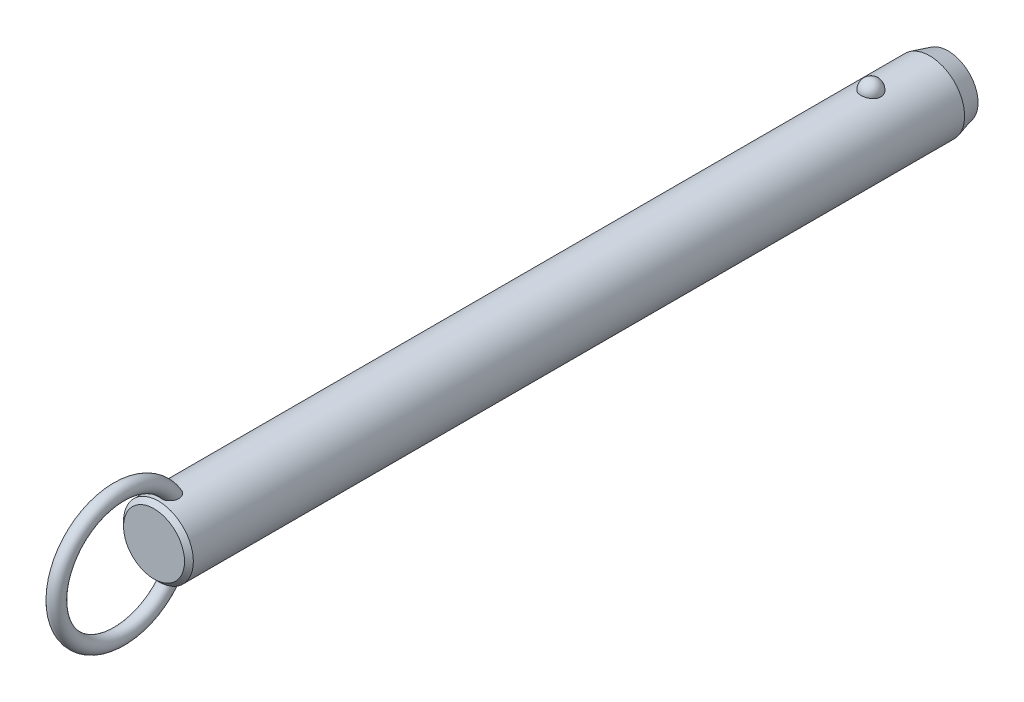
SolidWorks part; units mm, degrees
ref_plane "Front Plane" through (0, 0, 0) normal (0, 0, 1) x (1, 0, 0)
ref_plane "Top Plane" through (0, 0, 0) normal (0, 1, 0) x (1, 0, 0)
ref_plane "Right Plane" through (0, 0, 0) normal (1, 0, 0) x (0, 0, -1)
sketch "Sketch2" plane through (0, 0, 0) normal (0, 0, 1) x (1, 0, 0)
  circle A0 centre (0, 0) radius 9.5
  point P3 (0, 9.5)
  dimension "D1" = 19
extrude "Boss-Extrude1" add sketch "Sketch2" along normal blind 182.9
sketch "Sketch3" plane through (0, 0, 0) normal (0, 0, -1) x (-1, 0, 0)
  circle A0 centre (0, 0) radius 9.5
  dimension "D1" = 19
extrude "Boss-Extrude2" add sketch "Sketch3" along normal blind 23.7
chamfer "Chamfer1" distance 5 angle 15 1 edges at (-9.5, 0, -23.7)
sketch "Sketch12" plane through (0, 0, 0) normal (1, 0, 0) x (0, 0, -1)
  line L0 (-182.9, 9.5) -> (-182.9, -9.5) construction
  point P0 (-182.9, 0)
sketch "Sketch13" plane through (0, 0, 0) normal (1, 0, 0) x (0, 0, -1)
  circle A0 centre (-201.95, 0) radius 19.05
  point P2 (-182.9, 0)
  dimension "D1" = 38.1
sketch "Sketch14" plane through (0, 0, 0) normal (0, 1, 0) x (1, 0, 0)
  circle A0 centre (0, -184.9) radius 2
  point P2 (0, -182.9)
  dimension "D1" = 4
sweep "Sweep1" add profiles "Sketch14" path "Sketch13"
sketch "Sketch15" plane through (0, 0, 182.9) normal (0, 0, 1) x (1, 0, 0)
  circle A0 centre (0, 0) radius 9.5
  dimension "D1" = 19
extrude "Boss-Extrude3" add sketch "Sketch15" along normal blind 9.52
chamfer "Chamfer2" distance 1.2 angle 45 1 edges at (9.5, 0, 192.42)
sketch "Sketch18" plane through (0, 0, 0) normal (1, 0, 0) x (0, 0, -1)
  line L0 (18.7, 9.5) -> (-185.4378, 9.5) construction
  line L1 (2.7, 12.2) -> (2.7, 6.8)
  line L2 (-185.4378, -9.5) -> (18.7, -9.5) construction
  arc A0 (2.7, 12.2) -> (2.7, 6.8) centre (2.7, 9.5) ccw
  point P4 (0, 9.5)
  dimension "D1" = 21.7
revolve "Revolve1" add sketch "Sketch18" angle 360 about L1
